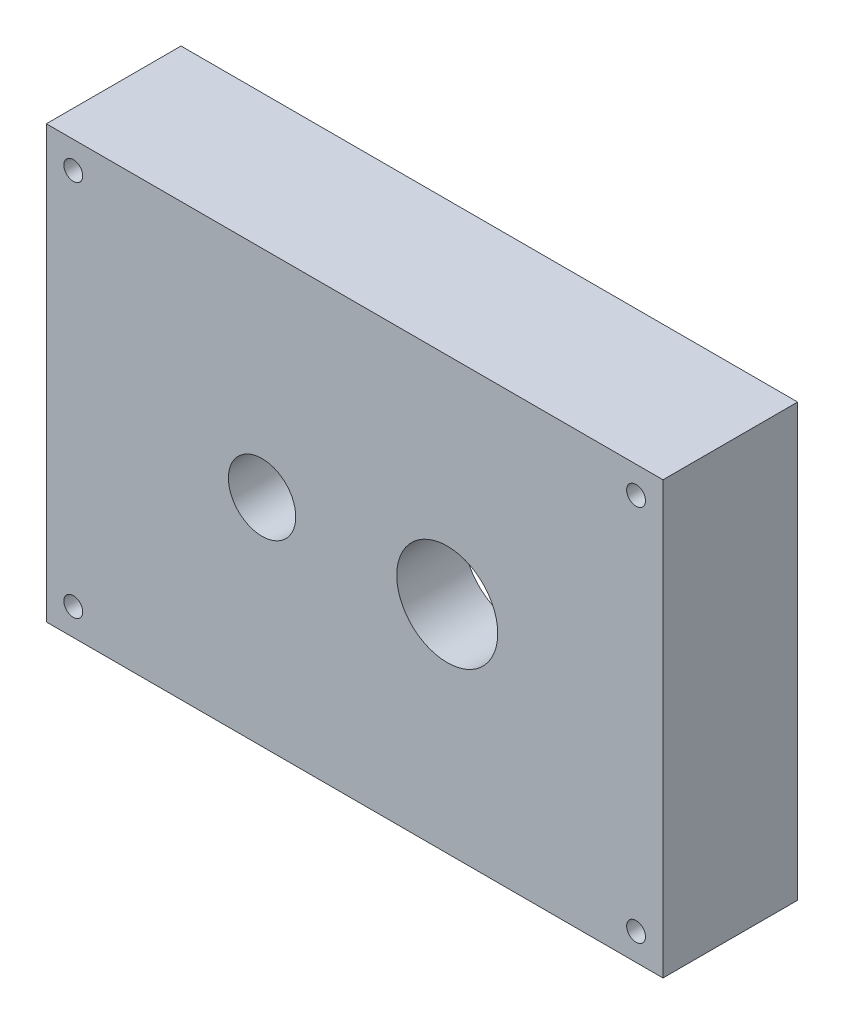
SolidWorks part; units mm, degrees
ref_plane "Front Plane" through (0, 0, 0) normal (0, 0, 1) x (1, 0, 0)
ref_plane "Top Plane" through (0, 0, 0) normal (0, 1, 0) x (1, 0, 0)
ref_plane "Right Plane" through (0, 0, 0) normal (1, 0, 0) x (0, 0, -1)
sketch "Sketch1" plane through (0, 0, 0) normal (0, 0, 1) x (1, 0, 0)
  line L1 (-29.0766, -20.3454) -> (29.0766, -20.3454)
  line L2 (-29.0766, -20.3454) -> (-29.0766, 20.3454)
  line L3 (-29.0766, 20.3454) -> (29.0766, 20.3454)
  line L4 (29.0766, -20.3454) -> (29.0766, 20.3454)
  line L5 (-29.0766, -20.3454) -> (29.0766, 20.3454) construction
  line L6 (-29.0766, 20.3454) -> (29.0766, -20.3454) construction
  point P0 (0, 0)
extrude "Boss-Extrude1" add sketch "Sketch1" along normal blind 12.7
sketch "Sketch2" plane through (0, 0, 0) normal (0, 0, 1) x (1, 0, 0)
  line L1 (-23.9966, -15.2654) -> (23.9966, -15.2654)
  line L2 (-23.9966, -15.2654) -> (-23.9966, 15.2654)
  line L3 (-23.9966, 15.2654) -> (23.9966, 15.2654)
  line L4 (23.9966, -15.2654) -> (23.9966, 15.2654)
  line L5 (-23.9966, -15.2654) -> (23.9966, 15.2654) construction
  line L6 (-23.9966, 15.2654) -> (23.9966, -15.2654) construction
  point P0 (0, 0)
extrude "Cut-Extrude1" cut sketch "Sketch2" along normal blind 6.35
sketch "Sketch3" plane through (0, 0, 0) normal (0, 0, 1) x (1, 0, 0)
  circle A0 centre (-8.7312, 0) radius 3.175
  circle A1 centre (8.7312, 0) radius 4.7625
extrude "Cut-Extrude2" cut sketch "Sketch3" along normal blind 12.7
sketch "Sketch4" plane through (0, 0, 0) normal (0, 0, 1) x (1, 0, 0)
  circle A0 centre (26.5367, 17.8054) radius 0.889
  circle A1 centre (-26.5367, 17.8054) radius 0.889
  circle A2 centre (26.5367, -17.8054) radius 0.889
  circle A3 centre (-26.5367, -17.8054) radius 0.889
extrude "Cut-Extrude3" cut sketch "Sketch4" along normal blind 12.7
equation "\"PD_p\"= 0.375in"
equation "\"PD_g\"= 1in"
equation "\"OD_g\"= 1.042in"
equation "\"CD\"= (\"PD_p\"+\"PD_g\")/2"
equation "\"c_gap\"= 0.08in"
equation "\"t_wall\"= 0.2in"
equation "\"L_cav\"= \"CD\"+\"OD_g\"+2*\"c_gap\""
equation "\"W_cav\"= \"OD_g\"+2*\"c_gap\""
equation "\"L_out\"= \"L_cav\"+2*\"t_wall\""
equation "\"W_out\"= \"W_cav\"+2*\"t_wall\""
equation "\"Z_half\"= 0.5in"
equation "\"Z_cav\"= 0.25in"
equation "\"D_boreP\"= 0.25in"
equation "\"D_boreG\"= 0.375in"
equation "\"D_bolt\"= 0.07in"
equation "\"HX\"= \"L_cav\"/2+\"t_wall\"/2"
equation "\"HY\"= \"W_cav\"/2+\"t_wall\"/2"
equation "\"D1@Sketch1@Part6.Part\"= \"L_out\""
equation "\"D2@Sketch1@Part6.Part\"= \"W_out\""
equation "\"D1@Boss-Extrude1\"= \"Z_half\""
equation "\"D1@Sketch2@Part6.Part\"= \"L_cav\""
equation "\"D2@Sketch2@Part6.Part\"= \"W_cav\""
equation "\"D1@Cut-Extrude1\"= \"Z_cav\""
equation "\"D1@Sketch3@Part6.Part\"= \"D_boreP\""
equation "\"D2@Sketch3@Part6.Part\"= \"CD\"/2"
equation "\"D3@Sketch3@Part6.Part\"= \"D_boreG\""
equation "\"D4@Sketch3@Part6.Part\"= \"CD\"/2"
equation "\"D1@Cut-Extrude2\"= \"Z_half\""
equation "\"D1@Sketch4@Part6.Part\"= \"D_bolt\""
equation "\"D2@Sketch4@Part6.Part\"= \"HX\""
equation "\"D3@Sketch4@Part6.Part\"= \"HY\""
equation "\"D4@Sketch4@Part6.Part\"= \"D_bolt\""
equation "\"D5@Sketch4@Part6.Part\"= \"HX\""
equation "\"D6@Sketch4@Part6.Part\"= \"HY\""
equation "\"D7@Sketch4@Part6.Part\"= \"D_bolt\""
equation "\"D8@Sketch4@Part6.Part\"= \"HX\""
equation "\"D9@Sketch4@Part6.Part\"= \"HY\""
equation "\"D10@Sketch4@Part6.Part\"= \"D_bolt\""
equation "\"D11@Sketch4@Part6.Part\"= \"HX\""
equation "\"D12@Sketch4@Part6.Part\"= \"HY\""
equation "\"D1@Cut-Extrude3\"= \"Z_half\""
